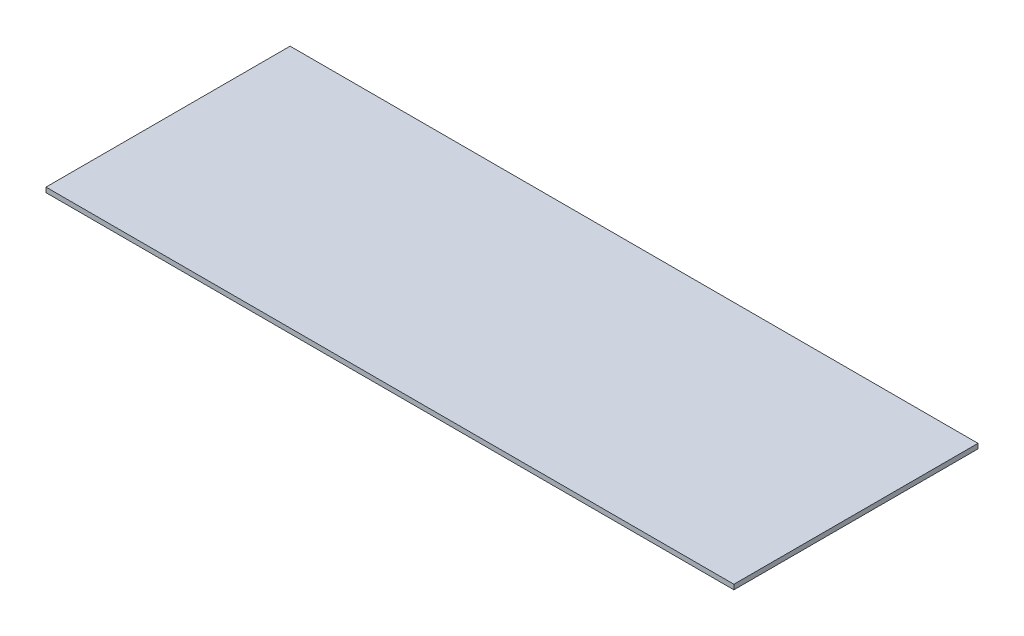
SolidWorks part; units mm, degrees
ref_plane "Front Plane" through (0, 0, 0) normal (0, 0, 1) x (1, 0, 0)
ref_plane "Top Plane" through (0, 0, 0) normal (0, 1, 0) x (1, 0, 0)
ref_plane "Right Plane" through (0, 0, 0) normal (1, 0, 0) x (0, 0, -1)
sketch "Sketch1" plane through (0, 0, 0) normal (0, 1, 0) x (1, 0, 0)
  line L1 (-393.7, -139.7) -> (393.7, -139.7)
  line L2 (-393.7, -139.7) -> (-393.7, 139.7)
  line L3 (-393.7, 139.7) -> (393.7, 139.7)
  line L4 (393.7, -139.7) -> (393.7, 139.7)
  line L5 (-393.7, -139.7) -> (393.7, 139.7) construction
  line L6 (-393.7, 139.7) -> (393.7, -139.7) construction
  point P0 (0, 0)
  dimension "D1" = 787.4
  dimension "D2" = 279.4
extrude "Boss-Extrude1" add sketch "Sketch1" along normal blind 5.5562
